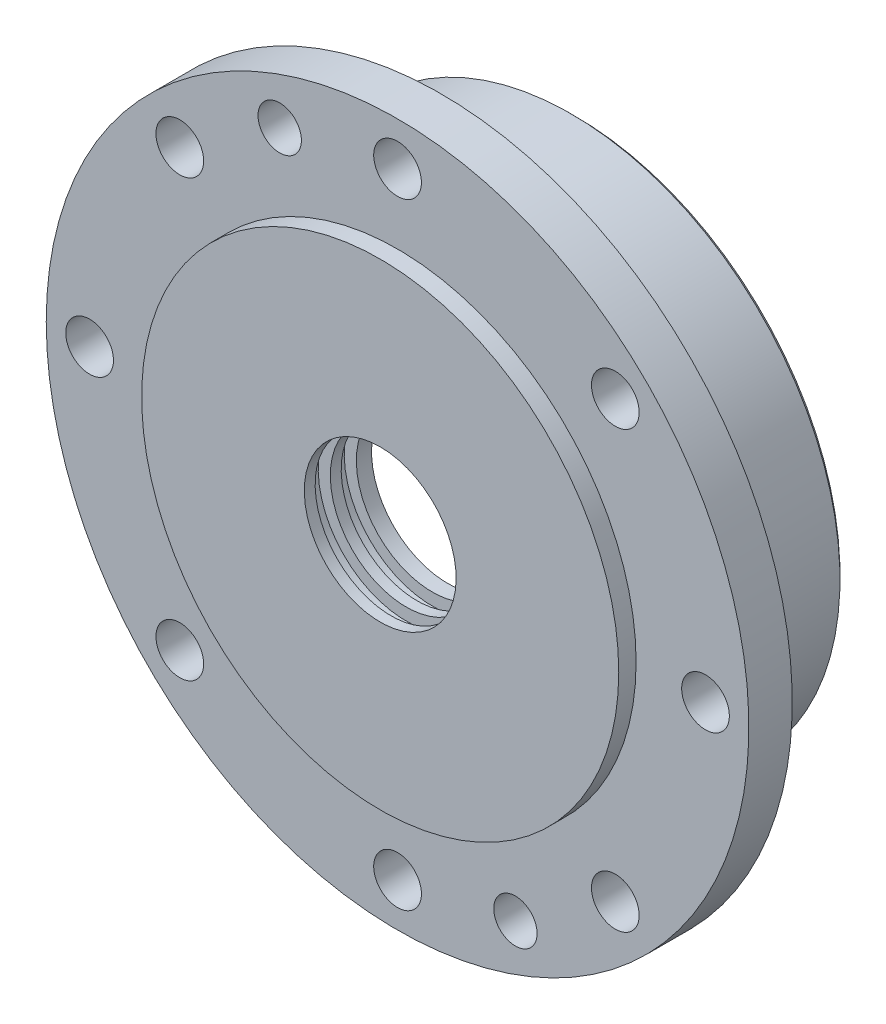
SolidWorks part; units mm, degrees
ref_plane "前视基准面" through (0, 0, 0) normal (0, 0, 1) x (1, 0, 0)
ref_plane "上视基准面" through (0, 0, 0) normal (0, 1, 0) x (1, 0, 0)
ref_plane "右视基准面" through (0, 0, 0) normal (1, 0, 0) x (0, 0, -1)
sketch "草图1" plane through (0, 0, 0) normal (0, 0, 1) x (1, 0, 0)
  circle A0 centre (0, 0) radius 55
  dimension "D1" = 110
extrude "凸台-拉伸1" add sketch "草图1" along normal blind 4
sketch "草图2" plane through (0, 0, 0) normal (0, 0, -1) x (-1, 0, 0)
  circle A0 centre (0, 0) radius 81
  dimension "D1" = 162
extrude "凸台-拉伸2" add sketch "草图2" along normal blind 10
sketch "草图3" plane through (0, 0, -10) normal (0, 0, -1) x (-1, 0, 0)
  circle A0 centre (0, 0) radius 62
  dimension "D1" = 124
extrude "凸台-拉伸3" add sketch "草图3" along normal blind 31
sketch "草图4" plane through (0, 0, 0) normal (1, 0, 0) x (0, 0, -1)
  line L0 (0, 0) -> (88.5704, 0) construction
  line L1 (41, -62) -> (41, 62) construction
  line L2 (41, 0) -> (32, 0)
  line L3 (41, 0) -> (41, 60)
  line L4 (41, 60) -> (32, 60)
  line L5 (32, 0) -> (32, 60)
  line L7 (32, 0) -> (29, 0)
  line L8 (32, 0) -> (32, 60.5)
  line L9 (32, 60.5) -> (29, 60.5)
  line L10 (29, 0) -> (29, 60.5)
  line L11 (29, 0) -> (13.5, 0)
  line L12 (29, 0) -> (29, 57.5)
  line L13 (29, 57.5) -> (13.5, 57.5)
  line L14 (13.5, 0) -> (13.5, 57.5)
  line L15 (13.5, 0) -> (12, 0)
  line L16 (13.5, 0) -> (13.5, 58)
  line L17 (13.5, 58) -> (12, 58)
  line L18 (12, 0) -> (12, 58)
  line L19 (12, 0) -> (11.5, 0)
  line L20 (12, 0) -> (12, 50)
  line L21 (12, 50) -> (11.5, 50)
  line L22 (11.5, 0) -> (11.5, 50)
  dimension "D1" = 60
  dimension "D2" = 9
  dimension "D3" = 3
  dimension "D4" = 60.5
  dimension "D5" = 57.5
  dimension "D6" = 15.5
  dimension "D7" = 58
  dimension "D8" = 1.5
  dimension "D9" = 50
  dimension "D10" = 0.5
revolve "切除-旋转1" cut sketch "草图4" angle 360 about L0
sketch "草图5" plane through (0, 0, 0) normal (1, 0, 0) x (0, 0, -1)
  line L0 (0, 0) -> (-64.7797, 0) construction
  line L1 (-4, 55) -> (-4, -55) construction
  line L2 (-4, 0) -> (-1.5, 0)
  line L3 (-4, 0) -> (-4, 17.5)
  line L4 (-4, 17.5) -> (-1.5, 17.5)
  line L5 (-1.5, 0) -> (-1.5, 17.5)
  line L7 (-1.5, 0) -> (2, 0)
  line L8 (-1.5, 0) -> (-1.5, 20.3)
  line L9 (-1.5, 20.3) -> (2, 20.3)
  line L10 (2, 0) -> (2, 20.3)
  line L11 (2, 0) -> (4.5, 0)
  line L12 (2, 0) -> (2, 17.5)
  line L13 (2, 17.5) -> (4.5, 17.5)
  line L14 (4.5, 0) -> (4.5, 17.5)
  line L15 (4.5, 0) -> (8, 0)
  line L16 (4.5, 0) -> (4.5, 20.3)
  line L17 (4.5, 20.3) -> (8, 20.3)
  line L18 (8, 0) -> (8, 20.3)
  line L19 (8, 0) -> (10.5, 0)
  line L20 (8, 0) -> (8, 17.5)
  line L21 (8, 17.5) -> (10.5, 17.5)
  line L22 (10.5, 0) -> (10.5, 17.5)
  dimension "D1" = 17.5
  dimension "D2" = 2.5
  dimension "D3" = 20.3
  dimension "D4" = 3.5
  dimension "D5" = 2.5
  dimension "D6" = 3.5
  dimension "D7" = 2.5
  dimension "D8" = 17.5
revolve "切除-旋转2" cut sketch "草图5" angle 360 about L0
sketch "草图6" plane through (0, 0, -10.5) normal (0, 0, 1) x (1, 0, 0)
  circle A0 centre (0, 0) radius 17.5
extrude "切除-拉伸1" cut sketch "草图6" against normal through all
sketch "草图7" plane through (0, 0, 0) normal (0, 0, 1) x (1, 0, 0)
  line L0 (0, 0) -> (0, 90.7954) construction
  circle A0 centre (0, 0) radius 71 construction
  circle A1 centre (0, 71) radius 5.5
  circle A2 centre (50.2046, 50.2046) radius 5.5
  circle A3 centre (71, 0) radius 5.5
  circle A4 centre (50.2046, -50.2046) radius 5.5
  circle A5 centre (0, -71) radius 5.5
  circle A6 centre (-50.2046, -50.2046) radius 5.5
  circle A7 centre (-71, 0) radius 5.5
  circle A8 centre (-50.2046, 50.2046) radius 5.5
  point P22 (0, 0)
  dimension "D1" = 142
  dimension "D2" = 11
  dimension "D3" = 8
extrude "切除-拉伸2" cut sketch "草图7" against normal through all
sketch "草图8" plane through (0, 0, 0) normal (0, 0, 1) x (1, 0, 0)
  line L0 (0, 0) -> (0, 61.8289) construction
  line L1 (0, 0) -> (-25.9953, 62.7583) construction
  line L2 (-25.9953, 62.7583) -> (-33.788, 81.5716) construction
  circle A0 centre (0, 0) radius 71 construction
  circle A1 centre (-27.1705, 65.5954) radius 5
  circle A2 centre (27.1705, -65.5954) radius 5
  point P14 (0, 0)
  dimension "D2" = 10
  dimension "D1" = 22.5
  dimension "D3" = 2
extrude "切除-拉伸3" cut sketch "草图8" against normal through all
chamfer "倒角1" distance 1 angle 45 1 edges at (-62, 0, -41)
